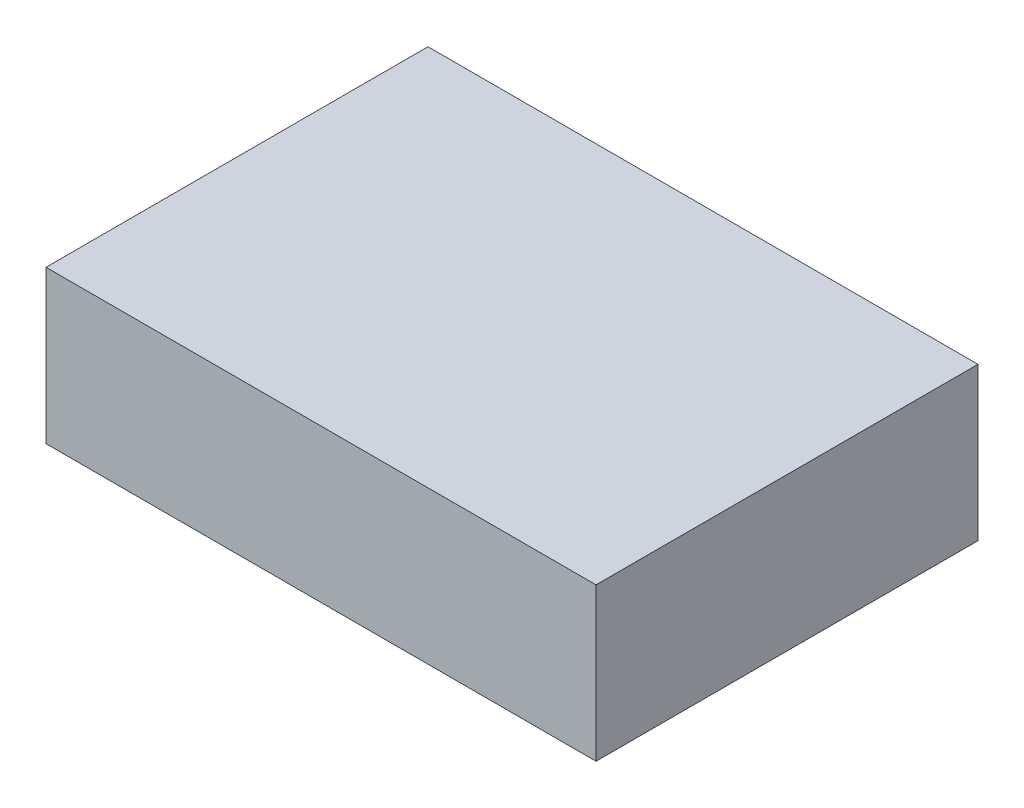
SolidWorks part; units mm, degrees
ref_plane "Front Plane" through (0, 0, 0) normal (0, 0, 1) x (1, 0, 0)
ref_plane "Top Plane" through (0, 0, 0) normal (0, 1, 0) x (1, 0, 0)
ref_plane "Right Plane" through (0, 0, 0) normal (1, 0, 0) x (0, 0, -1)
sketch "Sketch1" plane through (0, 0, 0) normal (0, 1, 0) x (1, 0, 0)
  line L1 (-18, 12.5) -> (18, 12.5)
  line L2 (-18, 12.5) -> (-18, -12.5)
  line L3 (-18, -12.5) -> (18, -12.5)
  line L4 (18, 12.5) -> (18, -12.5)
  line L5 (-18, 12.5) -> (18, -12.5) construction
  line L6 (-18, -12.5) -> (18, 12.5) construction
  point P0 (0, 0)
  dimension "D1" = 36
  dimension "D2" = 25
extrude "Boss-Extrude1" add sketch "Sketch1" along normal blind 10
